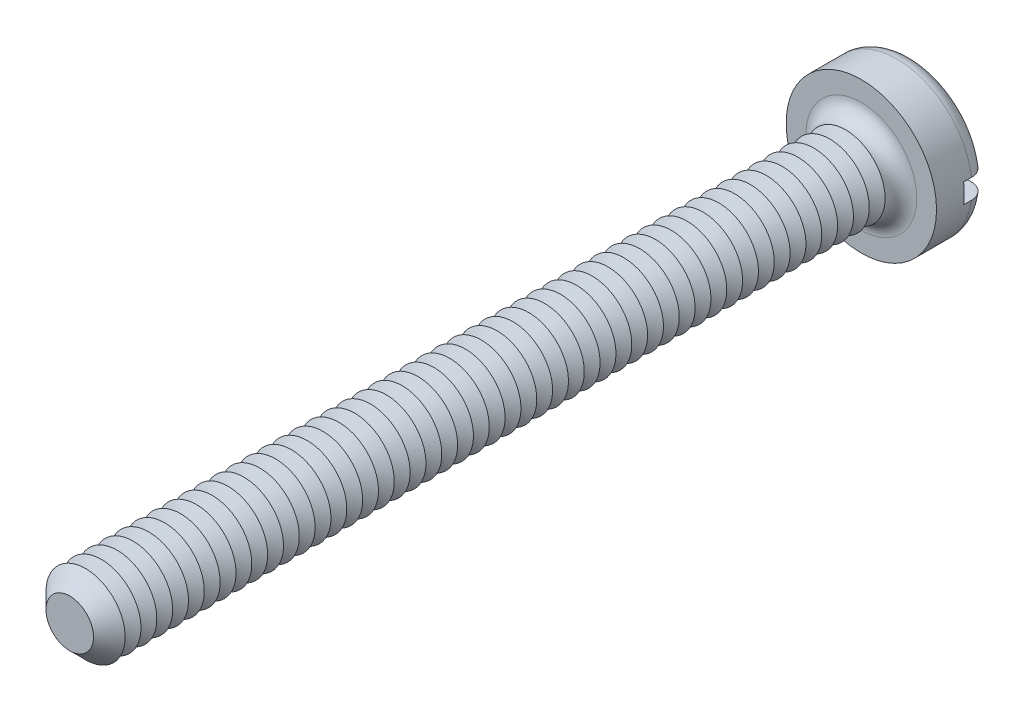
SolidWorks part; units mm, degrees
ref_plane "Front Plane" through (0, 0, 0) normal (0, 0, 1) x (1, 0, 0)
ref_plane "Top Plane" through (0, 0, 0) normal (0, 1, 0) x (1, 0, 0)
ref_plane "Right Plane" through (0, 0, 0) normal (1, 0, 0) x (0, 0, -1)
sketch "Sketch3" plane through (0, 0, 0) normal (0, 0, 1) x (1, 0, 0)
  circle A0 centre (0, 0) radius 1.9
  dimension "D1" = 3.8
extrude "Boss-Extrude2" add sketch "Sketch3" against normal blind 1.3
sketch "Sketch4" plane through (0, 0, 0) normal (0, 0, 1) x (1, 0, 0)
  circle A0 centre (0, 0) radius 1
  dimension "D1" = 2
extrude "Boss-Extrude3" add sketch "Sketch4" along normal blind 20
fillet "Fillet1" radius 0.4 2 edges at (1.9, 0, -1.3) (1, 0, 0)
chamfer "Chamfer1" distance 0.4 angle 45 1 edges at (1, 0, 20)
sketch "Sketch5" plane through (0, 0, 0) normal (1, 0, 0) x (0, 0, -1)
  line L0 (1.6944, 0) -> (-7.6738, 0) construction
sketch "Sketch6" plane through (0, 0, 0) normal (1, 0, 0) x (0, 0, -1)
  line L0 (-0.4, 1) -> (-0.6, 0.6536)
  line L1 (-0.6, 0.6536) -> (-0.8, 1)
  line L2 (-0.4, 1) -> (-19.6, 1) construction
  line L3 (-0.8, 1) -> (-0.4, 1)
  dimension "D1" = 0.4
revolve "Cut-Revolve1" cut sketch "Sketch6" angle 360 about L0
pattern_linear "LPattern1" count 48 spacing 0.4 along (0, 0, 1) of "Cut-Revolve1"
sketch "Sketch8" plane through (0, 0, -1.3) normal (0, 0, -1) x (-1, 0, 0)
  line L1 (1.9, -0.25) -> (-1.9, -0.25)
  line L2 (1.9, -0.25) -> (1.9, 0.25)
  line L3 (1.9, 0.25) -> (-1.9, 0.25)
  line L4 (-1.9, -0.25) -> (-1.9, 0.25)
  line L5 (1.9, -0.25) -> (-1.9, 0.25) construction
  line L6 (1.9, 0.25) -> (-1.9, -0.25) construction
  point P0 (0, 0)
  dimension "D1" = 3.8
  dimension "D2" = 0.5
extrude "Cut-Extrude1" cut sketch "Sketch8" against normal blind 0.6
